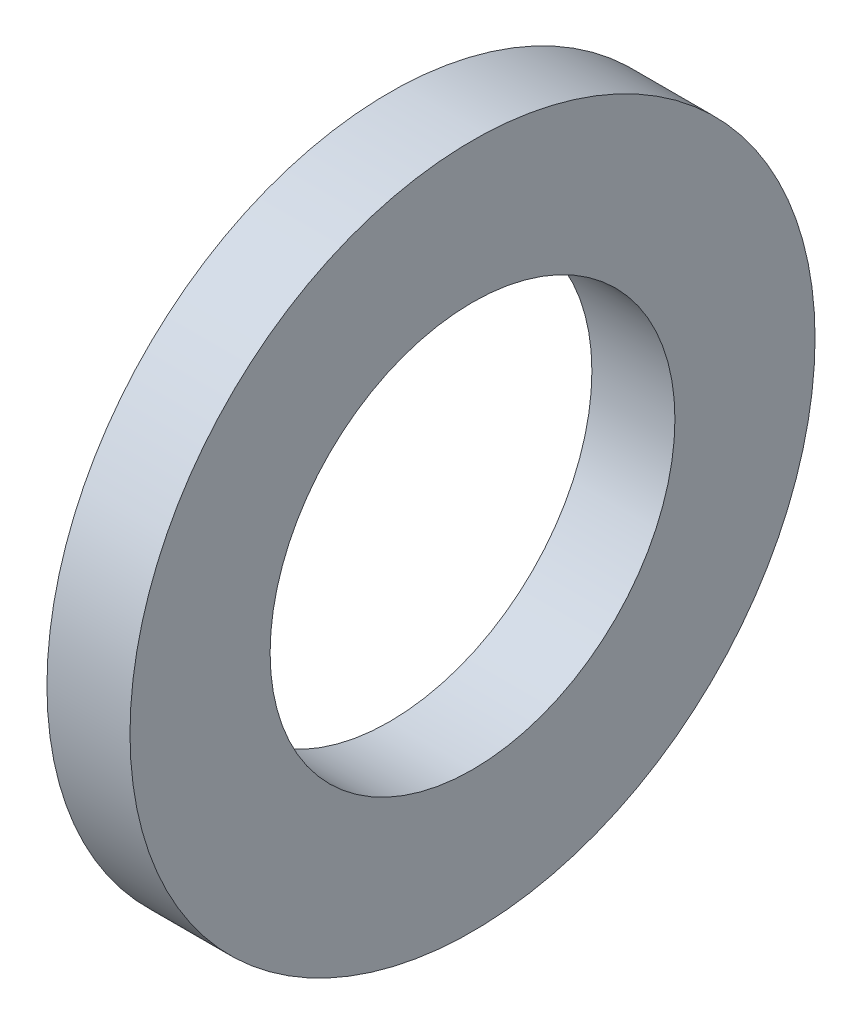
SolidWorks part; units mm, degrees
ref_plane "Plane1" through (0, 0, 0) normal (0, 0, 1) x (1, 0, 0)
ref_plane "Plane2" through (0, 0, 0) normal (0, 1, 0) x (1, 0, 0)
ref_plane "Plane3" through (0, 0, 0) normal (1, 0, 0) x (0, 0, -1)
other "Configuration Table"
sketch "Sketch1" plane through (0, 0, 0) normal (1, 0, 0) x (0, 0, -1)
  circle A0 centre (0, 0) radius 19.5
  circle A1 centre (0, 0) radius 33
  dimension "InsideDia" = 39
  dimension "OutsideDia" = 66
extrude "Base-Extrude" add sketch "Sketch1" along normal blind 8
